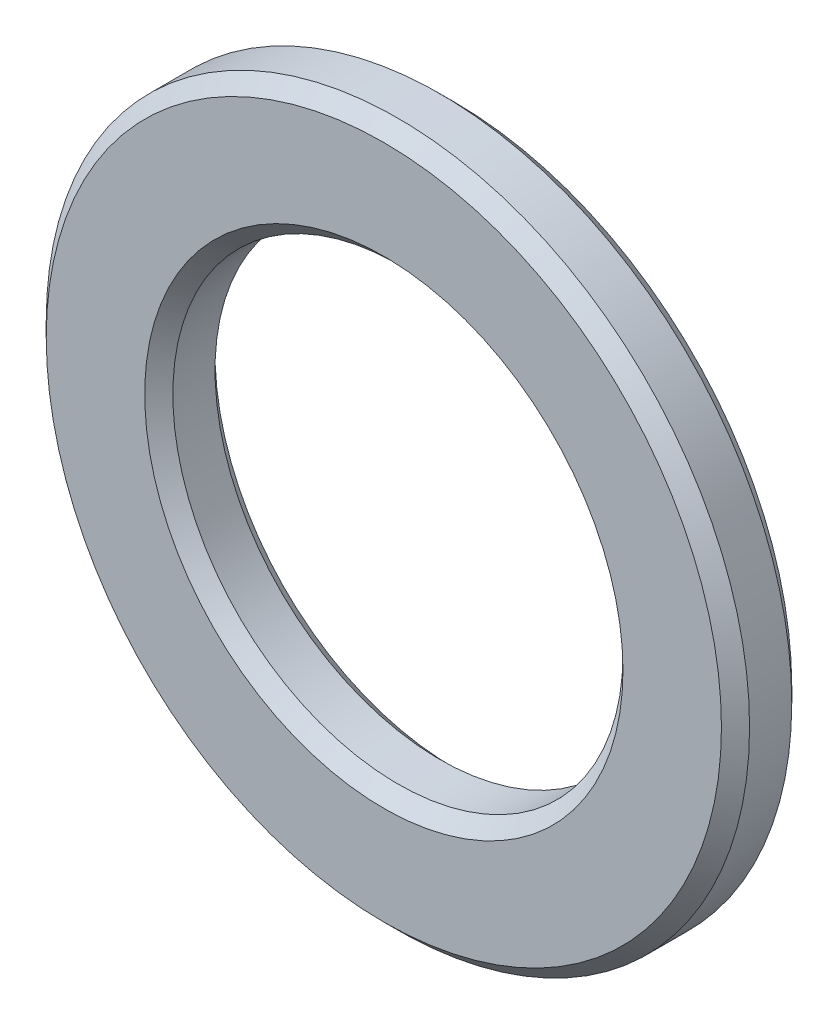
SolidWorks part; units mm, degrees
ref_plane "Front Plane" through (0, 0, 0) normal (0, 0, 1) x (1, 0, 0)
ref_plane "Top Plane" through (0, 0, 0) normal (0, 1, 0) x (1, 0, 0)
ref_plane "Right Plane" through (0, 0, 0) normal (1, 0, 0) x (0, 0, -1)
sketch "Sketch1" plane through (0, 0, 0) normal (0, 0, 1) x (1, 0, 0)
  circle A0 centre (0, 0) radius 5
  circle A1 centre (0, 0) radius 3.2
  dimension "D1" = 10
  dimension "D2" = 6.4
extrude "Boss-Extrude2" add sketch "Sketch1" along normal mid plane 1
chamfer "Chamfer3" distance 0.2 angle 45 4 edges at (5, 0, 0.5) (5, 0, -0.5) (3.2, 0, -0.5) (3.2, 0, 0.5)
